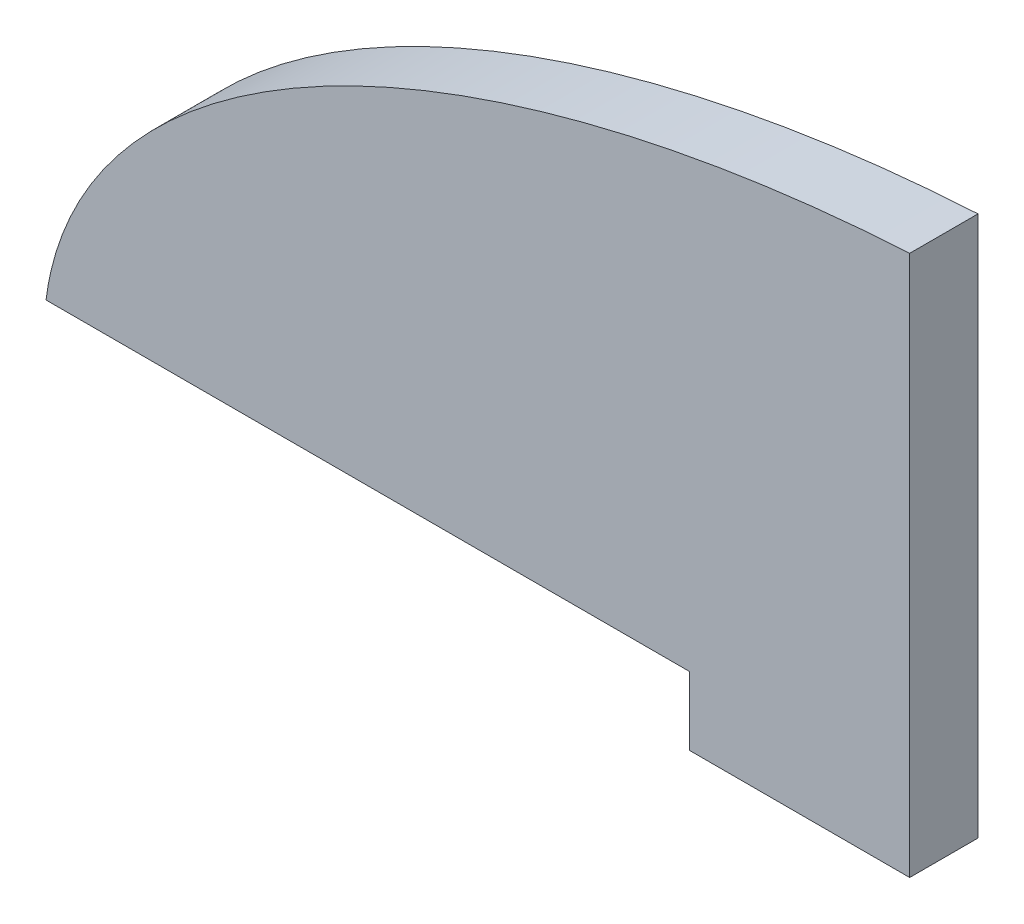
SolidWorks part; units mm, degrees
ref_plane "Front Plane" through (0, 0, 0) normal (0, 0, 1) x (1, 0, 0)
ref_plane "Top Plane" through (0, 0, 0) normal (0, 1, 0) x (1, 0, 0)
ref_plane "Right Plane" through (0, 0, 0) normal (1, 0, 0) x (0, 0, -1)
sketch "Sketch1" plane through (0, 0, 0) normal (0, 0, 1) x (1, 0, 0)
  line L0 (0, 0) -> (-4.7625, 0) construction
  line L1 (-4.7625, 0) -> (-4.7625, 23.5341)
  line L2 (-4.7625, 0) -> (-4.7625, -1.5875)
  line L3 (-4.7625, -1.5875) -> (-15, -1.5875)
  line L4 (-15, -1.5875) -> (-15, 1.5875)
  line L5 (-15, 1.5875) -> (-44.8987, 1.5875)
  ellipse E0 centre (0, 0) end of major axis (-45, 0) minor radius 20 construction
  ellipse E1 centre (0, 0) end of major axis (-45, 0) minor radius 23.6671 (-4.7625, 23.5341) -> (-44.8987, 1.5875) ccw
  point P6 (-4.7625, 27.7539)
  point P9 (-4.7625, 28.1099)
  point P14 (-4.7625, 23.6671)
  dimension "D1" = 3.175
  dimension "D2" = 10.2375
  dimension "D3" = 1.5875
  dimension "D4" = 4.7625
extrude "Boss-Extrude1" add sketch "Sketch1" along normal blind 3.175
